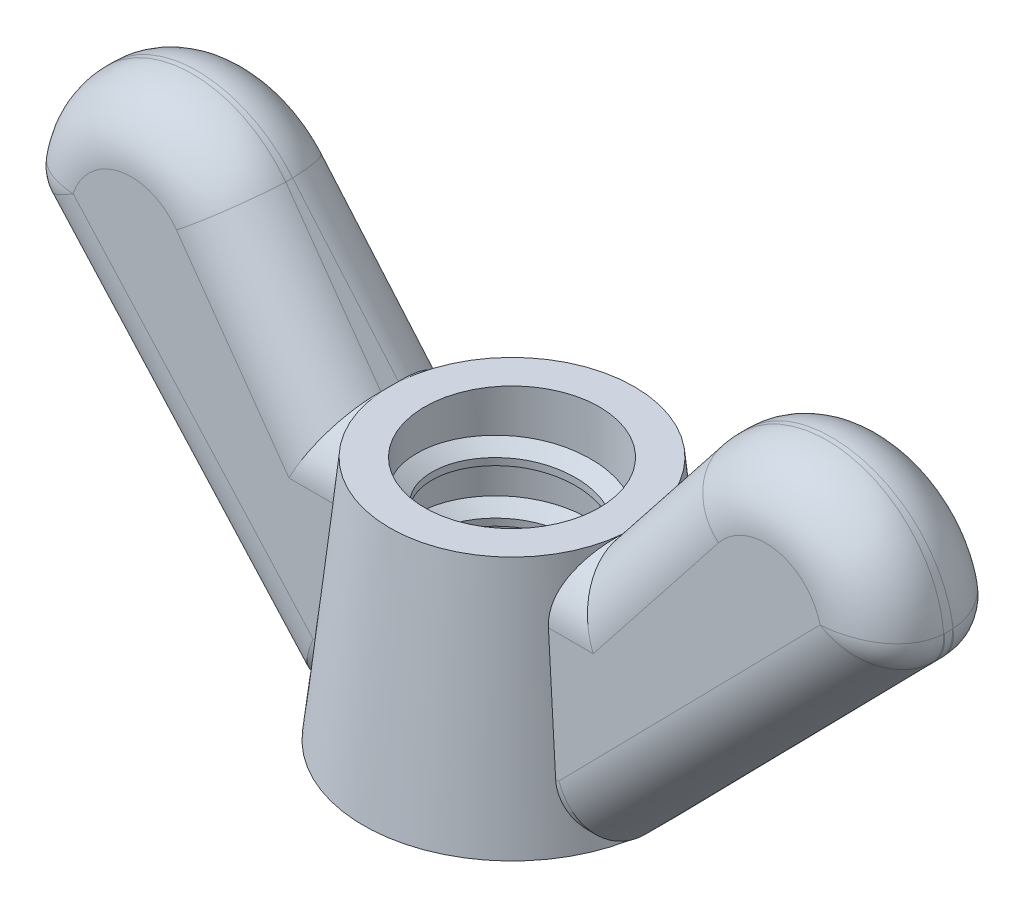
SolidWorks part; units mm, degrees
ref_plane "Front" through (0, 0, 0) normal (0, 0, 1) x (1, 0, 0)
ref_plane "Top" through (0, 0, 0) normal (0, 1, 0) x (1, 0, 0)
ref_plane "Right" through (0, 0, 0) normal (1, 0, 0) x (0, 0, -1)
sketch "Sketch1" plane through (0, 0, 0) normal (0, 0, 1) x (1, 0, 0)
  line L0 (-6.375, 10.6819) -> (-3.5, 7)
  line L1 (-3.5, 7) -> (3.5, 7)
  line L2 (0, -8.628) -> (0, 23.9666) construction
  line L3 (4.25, 0) -> (-4.25, 0)
  line L4 (-4.25, 0) -> (-12.5, 8.4)
  line L5 (4.25, 0) -> (12.5, 8.4)
  line L6 (6.375, 10.6819) -> (3.5, 7)
  arc A0 (-12.5, 8.4) -> (-6.375, 10.6819) centre (-9.0766, 8.5723) cw
  arc A1 (12.5, 8.4) -> (6.375, 10.6819) centre (9.0766, 8.5723) ccw
  point P14 (0, 0)
  point P15 (0, 7)
  dimension "D2" = 8.4
  dimension "A" = 8.5
  dimension "B" = 7
  dimension "C" = 7
  dimension "D" = 25
  dimension "H" = 12
  dimension "D3" = 12.75
extrude "Extrude1" add sketch "Sketch1" along normal mid plane 4.5
sketch "Sketch3" plane through (0, 0, 0) normal (1, 0, 0) x (0, 0, -1)
  line L0 (-2.25, 12) -> (-1.75, 12)
  line L1 (-1.75, 12) -> (-2.25, 0)
  line L2 (-2.25, 0) -> (2.25, 0) construction
  line L3 (-2.25, 0) -> (-2.25, 12)
  line L4 (0, 0) -> (0, 12) construction
  line L5 (2.25, 12) -> (-2.25, 12) construction
  line L6 (2.25, 0) -> (2.25, 12)
  line L7 (2.25, 12) -> (1.75, 12)
  line L8 (1.75, 12) -> (2.25, 0)
  dimension "G1" = 3.5
extrude "Cut-Extrude1" cut sketch "Sketch3" against normal through all and the other way through all
fillet "Fillet7" radius 1.75 16 edges at (-8.375, 4.2, -2.075) (0, 0, -2.25) (8.375, 4.2, -2.075) (10.2733, 11.7843, -1.759) (4.9375, 8.8409, -1.8816) (0, 7, -1.9583) (-4.9375, 8.8409, -1.8816) (-10.2733, 11.7843, -1.759) (-8.375, 4.2, 2.075) (-10.2733, 11.7843, 1.759) (-4.9375, 8.8409, 1.8816) (0, 7, 1.9583) (4.9375, 8.8409, 1.8816) (10.2733, 11.7843, 1.759) (8.375, 4.2, 2.075) (0, 0, 2.25)
fillet "Fillet8" radius 1.05 10 edges at (12.1668, 8.5861, -1.1746) (12.5, 8.4, 0) (-12.1668, 8.5861, -1.1746) (-12.5, 8.4, 0) (12.1668, 8.5861, 1.1746) (-12.1668, 8.5861, 1.1746)
sketch "Sketch2" plane through (0, 0, 0) normal (0, 0, 1) x (1, 0, 0)
  line L0 (0, 13.3086) -> (0, -17.8946) construction
  line L1 (-3.5, 7) -> (-4.25, 0)
  line L2 (-4.25, 0) -> (-2.5, 0)
  line L4 (-2.5, 0) -> (-2.5, -10)
  line L5 (-2.5, -10) -> (0, -10)
  line L6 (0, -10) -> (0, 7)
  line L8 (0, 7) -> (-3.5, 7)
  line L9 (-4.25, 0) -> (4.25, 0) construction
  dimension "d" = 5
  dimension "L" = 10
revolve "Revolve1" add sketch "Sketch2" angle 360 about L0
sketch "Sketch4" plane through (0, -10, 0) normal (0, -1, 0) x (1, 0, 0)
  circle A0 centre (0, 0) radius 2.5
  circle A1 centre (0, 0) radius 2.5 construction
extrude "Cut-Extrude2" cut sketch "Sketch4" against normal through all
thread "Filettatura1" pitch 0.8 start angle 0, offset 0, length 0, pitch 1.5, diameter 5
ref_plane "Piano1" through (2.5, 0, 0) normal (0, 0, 1) x (1, 0, 0)
sketch "Profilo filettatura1" plane through (2.5, 0, 0) normal (0, 0, 1) x (1, 0, 0)
  line L0 (0, 0) -> (0, 0.8) construction
  line L11 (0, 0) -> (0, 0.7)
  line L12 (0, 0.7) -> (-0.433, 0.45)
  line L13 (-0.433, 0.45) -> (-0.433, 0.25)
  line L15 (-0.433, 0.25) -> (0, 0)
  line L17 (-0.433, 0.35) -> (0, 0.35) construction
  point P2 (0, 0)
  dimension "Pitch" = 0.8
  dimension "Profile_Angle" = 60
  dimension "Profile_Land" = 0.2
  dimension "Profile_Height" = 0.433
equation "\"D2@Sketch1\" = \"H@Sketch1\"*0.7"
equation "\"D3@Sketch1\" = \"A@Sketch1\"*1.5"
equation "\"D1@Fillet7\" = \"G1@Sketch3\"/2"
equation "\"D1@Fillet8\" = \"D1@Fillet7\"*0.6"
